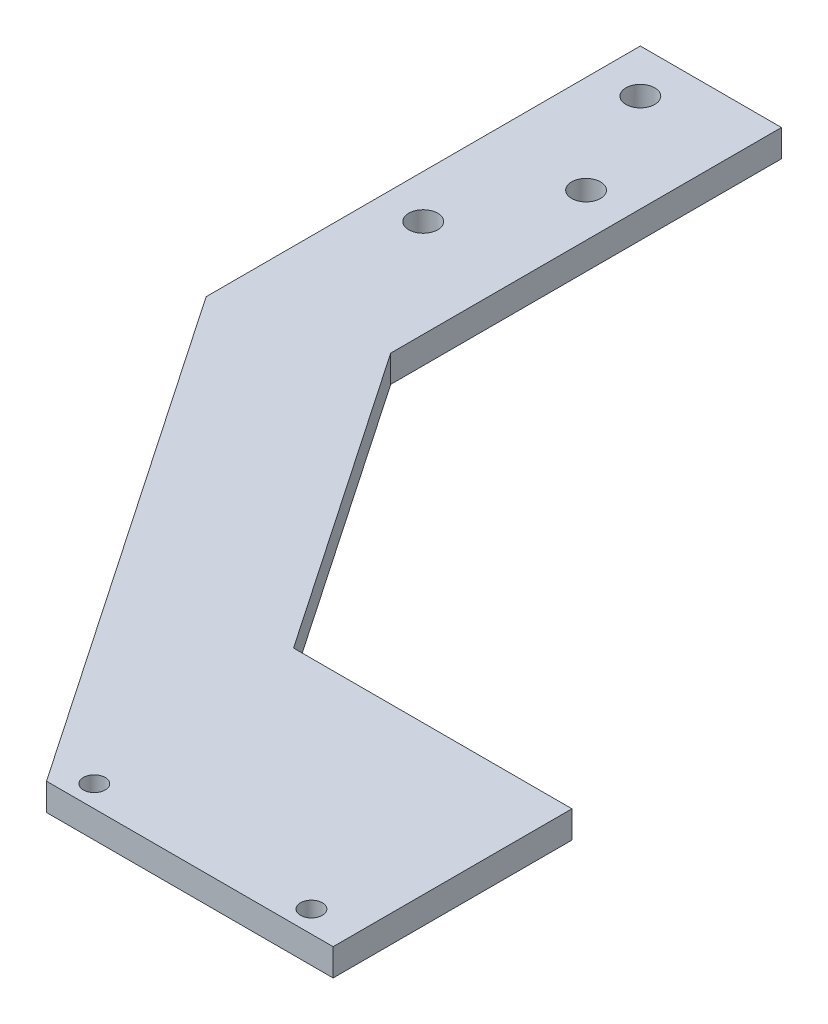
SolidWorks part; units mm, degrees
ref_plane "Front" through (0, 0, 0) normal (0, 0, 1) x (1, 0, 0)
ref_plane "Top" through (0, 0, 0) normal (0, 1, 0) x (1, 0, 0)
ref_plane "Right" through (0, 0, 0) normal (1, 0, 0) x (0, 0, -1)
sketch "Sketch1" plane through (0, 0, 0) normal (0, 1, 0) x (1, 0, 0)
  line L0 (0, 0) -> (33.02, 0)
  line L1 (33.02, 0) -> (33.02, -91.4314)
  line L2 (81.4184, -162.56) -> (146.558, -162.56)
  line L3 (146.558, -162.56) -> (146.558, -218.44)
  line L4 (146.558, -218.44) -> (79.502, -218.44)
  line L5 (0, -101.6) -> (0, 0)
  line L6 (10.16, -10.16) -> (10.16, -60.96) construction
  line L7 (10.16, -35.56) -> (22.86, -35.56) construction
  line L8 (85.598, -213.36) -> (136.398, -213.36) construction
  line L9 (81.4184, -162.56) -> (33.02, -91.4314)
  line L10 (79.502, -218.44) -> (0, -101.6)
  circle A0 centre (10.16, -10.16) radius 3.302 construction
  circle A1 centre (10.16, -60.96) radius 3.302 construction
  circle A2 centre (22.86, -35.56) radius 3.302 construction
  circle A3 centre (85.598, -213.36) radius 3.1573 construction
  circle A4 centre (136.398, -213.36) radius 3.1573 construction
  point P4 (0, 0)
  point P7 (137.8195, -162.56)
  point P22 (84.2911, -162.56)
  point P23 (0, 0)
  point P24 (33.02, -86.3715)
  dimension "D2" = 6.604
  dimension "D1" = 33.02
  dimension "D3" = 50.8
  dimension "D4" = 12.7
  dimension "D5" = 10.16
  dimension "D6" = 5.08
  dimension "D7" = 50.8
  dimension "D8" = 10.16
  dimension "D9" = 10.16
  dimension "D10" = 75.438
  dimension "D11" = 50.8
  dimension "D12" = 152.4
  dimension "D13" = 101.6
  dimension "D14" = 6.096
  dimension "D15" = 33.02
extrude "Boss-Extrude1" add sketch "Sketch1" along normal blind 6.35
sketch "Sketch2" plane through (0, 6.35, 0) normal (0, 1, 0) x (1, 0, 0)
  point P0 (10.16, -10.16)
  point P3 (22.86, -35.56)
  point P6 (10.16, -60.96)
  point P16 (0, 0)
  point P17 (0, 0)
hole_wizard "1/4 Clearance Hole1" positions "Sketch2" profile "Sketch3" hole size "1/4" standard "ANSI Inch"
sketch "Sketch3" plane through (10.16, 6.35, 10.16) normal (1, 0, 0) x (0, 0, 1)
  line L0 (0, 0) -> (0, 18.5398)
  line L1 (0, 18.5398) -> (3.3782, 16.51)
  line L2 (3.3782, 16.51) -> (3.3782, 0)
  line L5 (3.3782, 0) -> (0, 0)
  line L10 (0, 18.5398) -> (-3.3782, 16.51) construction
  line L11 (0, -6.35) -> (0, 107.95) construction
  dimension "Hole Dia." = 6.7564
  dimension "Hole Depth" = 16.51
  dimension "Drill Angle" = 118
sketch "Sketch4" plane through (0, 6.35, 0) normal (0, 1, 0) x (1, 0, 0)
  point P0 (85.598, -213.36)
  point P2 (136.398, -213.36)
  point P5 (0, 0)
  point P9 (0, 0)
hole_wizard "#10 Clearance Hole1" positions "Sketch4" profile "Sketch5" hole size "#10" standard "ANSI Inch"
sketch "Sketch5" plane through (85.598, 6.35, 213.36) normal (1, 0, 0) x (0, 0, 1)
  line L0 (0, 0) -> (0, 18.0438)
  line L1 (0, 18.0438) -> (2.5527, 16.51)
  line L2 (2.5527, 16.51) -> (2.5527, 0)
  line L5 (2.5527, 0) -> (0, 0)
  line L10 (0, 18.0438) -> (-2.5527, 16.51) construction
  line L11 (0, -6.35) -> (0, 107.95) construction
  dimension "Hole Dia." = 5.1054
  dimension "Hole Depth" = 16.51
  dimension "Drill Angle" = 118
